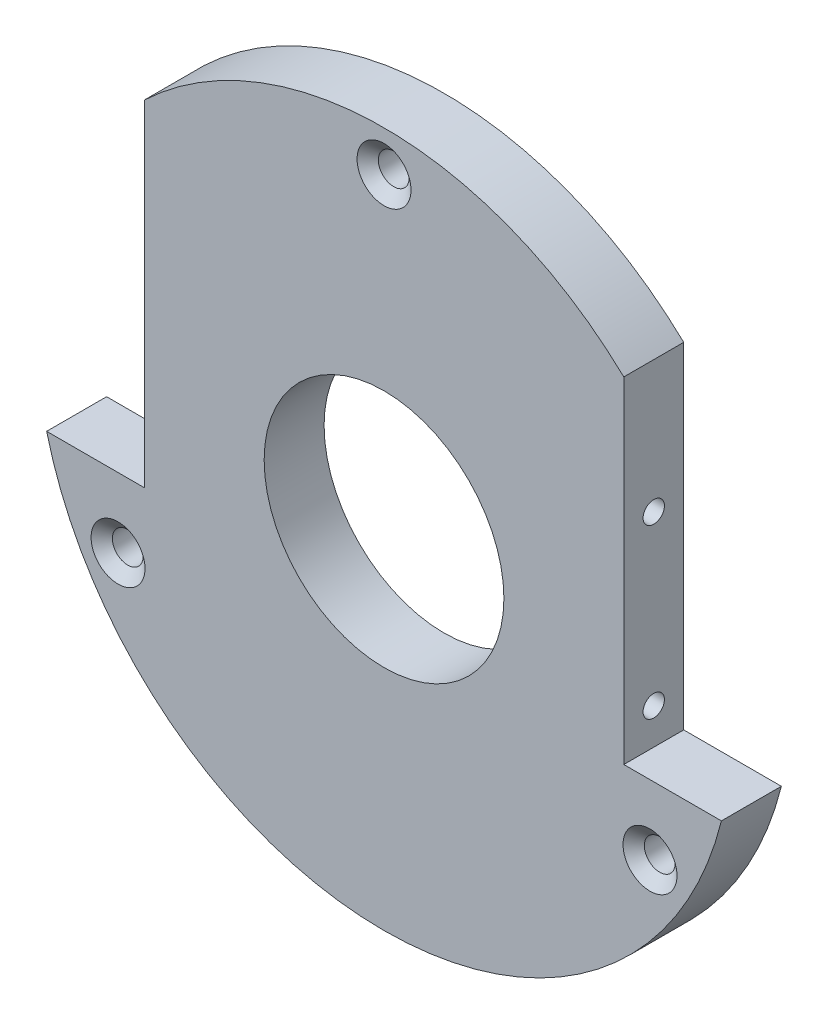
SolidWorks part; units mm, degrees
ref_plane "Front Plane" through (0, 0, 0) normal (0, 0, 1) x (1, 0, 0)
ref_plane "Top Plane" through (0, 0, 0) normal (0, 1, 0) x (1, 0, 0)
ref_plane "Right Plane" through (0, 0, 0) normal (1, 0, 0) x (0, 0, -1)
sketch "Sketch1" plane through (0, 0, 0) normal (0, 0, 1) x (1, 0, 0)
  circle A0 centre (0, 0) radius 36.83
  dimension "D1" = 73.66
extrude "Extrude1" add sketch "Sketch1" along normal blind 6.35
hole_wizard "CSK for #4 Flat Head Machine Screw (100)1" positions "3DSketch1" profile "Sketch3" countersink size "#4" standard "Ansi Inch"
sketch3d "3DSketch1"
  circle A0 centre (0, 0, 6.35) radius 36.83 construction
  point P0 (0, 32.5374, 6.35)
  point P15 (0, 0, 43.18)
  dimension "D1" = 32.5374
sketch "Sketch3" plane through (0, 32.5374, 6.35) normal (1, 0, 0) x (0, -1, 0)
  line L0 (0, 0) -> (0, 6.35)
  line L1 (0, 6.35) -> (1.6319, 6.35)
  line L2 (1.6319, 6.35) -> (1.6319, 1.0284)
  line L3 (1.6319, 1.0284) -> (2.8575, 0)
  line L5 (2.8575, 0) -> (0, 0)
  line L6 (-1.6319, 1.0284) -> (-2.8575, 0) construction
  line L11 (0, -6.35) -> (0, 107.95) construction
  dimension "Thru Hole Dia." = 3.2639
  dimension "Thru Hole Depth" = 6.35
  dimension "Near C'Sink Dia." = 5.715
  dimension "Near C'Sink Angle" = 100
pattern_circular "CirPattern1" count 3 over 360 about axis through (0, 0, 0) along (0, 0, 1) of "CSK for #4 Flat Head Machine Screw (100)1"
sketch "Sketch4" plane through (0, 0, 6.35) normal (0, 0, 1) x (1, 0, 0)
  line L0 (-27.94, -8.89) -> (-43.4608, -8.89)
  line L1 (-25.4, 42.9291) -> (25.4, 42.9291)
  line L2 (-25.4, 42.9291) -> (-25.4, -8.89)
  line L3 (-27.94, -8.89) -> (-25.4, -8.89)
  line L4 (25.4, 42.9291) -> (25.4, -8.89)
  line L5 (-43.4608, -8.89) -> (-43.4608, 52.0999)
  line L6 (-43.4608, 52.0999) -> (40.8452, 52.0999)
  line L7 (27.94, -8.89) -> (40.8452, -8.89)
  line L8 (40.8452, -8.89) -> (40.8452, 52.0999)
  line L10 (27.94, -8.89) -> (25.4, -8.89)
  dimension "D1" = 50.8
  dimension "D2" = 25.4
  dimension "D3" = 8.89
  dimension "D5" = 8.89
extrude "Extrude2" cut sketch "Sketch4" against normal through all
hole_wizard "#4-40 Tapped Hole1" positions "3DSketch2" profile "Sketch5" tap size "#4-40" standard "Ansi Inch"
sketch3d "3DSketch2"
  line L0 (-25.4, -8.89, 0) -> (-25.4, -8.89, 6.35) construction
  line L1 (-25.4, -8.89, 0) -> (-25.4, 26.67, 0) construction
  point P0 (-25.4, -5.08, 3.175)
  point P2 (-25.4, 12.7, 3.175)
  dimension "D1" = 17.78
  dimension "D2" = 3.81
  dimension "D3" = 3.175
sketch "Sketch5" plane through (-25.4, -5.08, 3.175) normal (0, 1, 0) x (0, 0, 1)
  line L0 (0, 0) -> (0, 12.1092)
  line L1 (0, 12.1092) -> (1.1303, 11.43)
  line L2 (1.1303, 11.43) -> (1.1303, 0)
  line L5 (1.1303, 0) -> (0, 0)
  line L10 (0, 12.1092) -> (-1.1303, 11.43) construction
  line L11 (0, -6.35) -> (0, 107.95) construction
  dimension "Tap Drill Dia." = 2.2606
  dimension "Tap Drill Depth" = 11.43
  dimension "Drill Angle" = 118
mirror "Mirror1" about plane through (0, 0, 0) normal (1, 0, 0) of "#4-40 Tapped Hole1"
sketch "Sketch6" plane through (0, 0, 0) normal (0, 0, -1) x (-1, 0, 0)
  circle A0 centre (0, 0) radius 12.7
extrude "Extrude3" cut sketch "Sketch6" against normal through all
